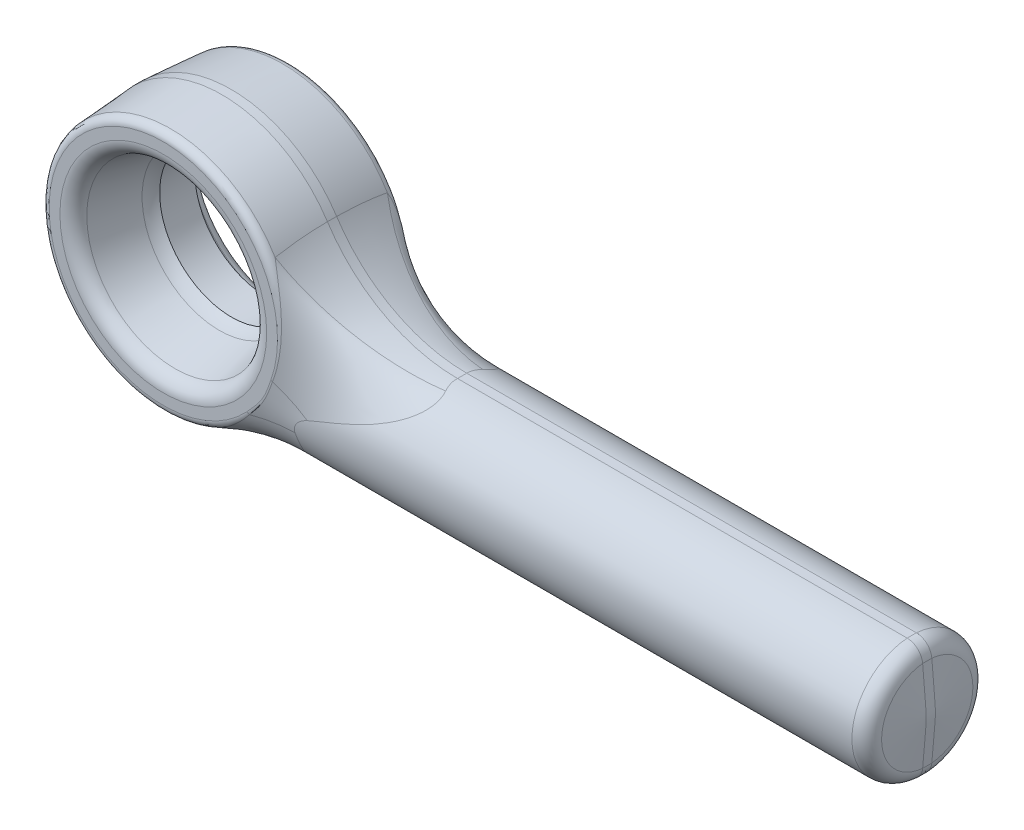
SolidWorks part; units mm, degrees
ref_plane "Plan1" through (0, 0, 0) normal (0, 0, 1) x (1, 0, 0)
ref_plane "Plan2" through (0, 0, 0) normal (0, 1, 0) x (1, 0, 0)
ref_plane "Plan3" through (0, 0, 0) normal (1, 0, 0) x (0, 0, -1)
sketch "Esquisse1" plane through (0, 0, 0) normal (0, 0, 1) x (1, 0, 0)
  circle A0 centre (0, 0) radius 16.2
  dimension "D1" = 32.4
extrude "Base-Extrusion" add sketch "Esquisse1" along normal mid plane 16.3 draft 4
sketch "Esquisse2" plane through (0, 0, 0) normal (0, 0, 1) x (1, 0, 0)
  line L0 (-20, 0) -> (20, 0) construction
  line L1 (-20, -8) -> (94.3291, -8) construction
  line L2 (0, -15.7) -> (88.1673, -15.7)
  line L3 (90.1597, -13.8743) -> (90.6737, -8)
  line L4 (0, -15.7) -> (0, -8)
  line L5 (0, -8) -> (90.6737, -8)
  circle A0 centre (0, 0) radius 15.6301 construction
  arc A1 (90.1597, -13.8743) -> (88.1673, -15.7) centre (88.1673, -13.7) cw
  point P13 (90, -15.7)
  dimension "D5" = 2
  dimension "D1" = 8
  dimension "D2" = 7.7
  dimension "D3" = 95
  dimension "D4" = 90
revolve "Boss.-Révol.1" add sketch "Esquisse2" angle 360 about L1
fillet "Congé4" radius 1
fillet "Congé5" radius 20
sketch "Esquisse3" plane through (0, 0, 0) normal (0, 1, 0) x (1, 0, 0)
  line L0 (0, 20.6238) -> (0, -15.1969) construction
  line L1 (0, 0) -> (0, -7.2198) construction
  line L2 (11.7426, -8.15) -> (0, -8.15)
  line L3 (0, 2.85) -> (0, -8.15)
  line L4 (-14.6976, -8.15) -> (14.6976, -8.15) construction
  line L5 (9, 2.85) -> (11.7426, -8.15)
  line L7 (-32.9547, 0) -> (48.0586, 0) construction
  line L8 (-20, 0) -> (94.3291, 0) construction
  line L9 (0, 2.85) -> (9, 2.85)
  dimension "D2" = 9
  dimension "D1" = 14
  dimension "D4" = 11
revolve "Enlèvement de matière-Révolution1" cut sketch "Esquisse3" angle 360 about L0
fillet "Congé13" radius 5
fillet "Congé15" radius 2
sketch "Esquisse5" plane through (0, 0, 0) normal (0, 1, 0) x (1, 0, 0)
  line L0 (0, 16.1009) -> (0, -12.7842) construction
  line L1 (0, 0) -> (0, -7.2198) construction
  line L2 (0, 5.15) -> (10.8, 5.15)
  line L4 (0, 8.15) -> (0, 5.15)
  line L5 (10.8, 5.15) -> (11.548, 8.15)
  line L6 (11.548, 8.15) -> (0, 8.15)
  line L7 (14.6976, 8.15) -> (-14.6976, 8.15) construction
  dimension "D3" = 14
  dimension "D2" = 10.8
  dimension "D1" = 3
revolve "Enlèvement de matière-Révolution2" cut sketch "Esquisse5" angle 360 about L0
fillet "Congé16" radius 2
fillet "Congé17" radius 2
scale "Echelle1"
sketch "Esquisse7" plane through (0, 0, 0) normal (0, 0, 1) x (1, 0, 0)
  line L0 (97.4644, -1.6368) -> (98.0316, -8.12)
  line L1 (97.4644, -14.6032) -> (98.0316, -8.12)
  line L24 (6.0879, -21.9105) -> (89.4898, -21.9105)
  line L25 (89.4898, 5.6705) -> (30.8393, 5.6705)
  arc A0 (3.7119, -22.1086) -> (6.0879, -21.9105) centre (6.0879, -36.2605) cw
  arc A1 (18.8032, 12.2068) -> (30.8393, 5.6705) centre (30.8393, 20.0205) ccw
  circle A2 centre (0, 0) radius 14
  arc A15 (89.4898, -21.9105) -> (97.4644, -14.6032) centre (89.4898, -13.9055) ccw
  arc A16 (18.8032, 12.2068) -> (3.7119, -22.1086) centre (0, 0) ccw
  arc A17 (97.4644, -1.6368) -> (89.4898, 5.6705) centre (89.4898, -2.3345) ccw
  dimension "D2" = 14.35
  dimension "D3" = 14.35
  dimension "D1" = 28
  dimension "D4" = 170
extrude "Boss.-Extru.1" add sketch "Esquisse7" along normal mid plane 1.2
sketch "Esquisse8" plane through (0, 0, 0) normal (0, 0, 1) x (1, 0, 0)
  line L0 (0, 0) -> (0, -82.1677) construction
  line L1 (0, -42.3205) -> (89.4898, -42.3205)
  line L16 (117.7967, -16.382) -> (118.5196, -8.12)
  line L17 (118.5196, -8.12) -> (117.7967, 0.142)
  line L18 (89.4898, 26.0805) -> (49.0921, 26.0805)
  line L20 (97.4644, -14.6032) -> (98.0316, -8.12)
  line L21 (98.0316, -8.12) -> (97.4644, -1.6368)
  line L22 (89.4898, 5.6705) -> (30.8393, 5.6705)
  line L23 (6.0879, -21.9105) -> (89.4898, -21.9105)
  line L24 (97.4644, -14.6032) -> (98.0316, -8.12)
  line L25 (98.0316, -8.12) -> (97.4644, -1.6368)
  line L26 (89.4898, 5.6705) -> (30.8393, 5.6705)
  line L27 (6.0879, -21.9105) -> (89.4898, -21.9105)
  arc A0 (25.238, 33.9716) -> (0, -42.3205) centre (0, 0) ccw
  arc A1 (49.0921, 26.0805) -> (25.238, 33.9716) centre (49.0921, 66.0805) cw
  arc A18 (89.4898, -42.3205) -> (117.7967, -16.382) centre (89.4898, -13.9055) ccw
  arc A19 (117.7967, 0.142) -> (89.4898, 26.0805) centre (89.4898, -2.3345) ccw
  arc A21 (89.4898, -21.9105) -> (97.4644, -14.6032) centre (89.4898, -13.9055) ccw
  arc A22 (97.4644, -1.6368) -> (89.4898, 5.6705) centre (89.4898, -2.3345) ccw
  arc A23 (18.8032, 12.2068) -> (30.8393, 5.6705) centre (30.8393, 20.0205) ccw
  arc A24 (18.8032, 12.2068) -> (3.7119, -22.1086) centre (0, 0) ccw
  arc A25 (6.0879, -21.9105) -> (3.7119, -22.1086) centre (6.0879, -36.2605) ccw
  arc A26 (89.4898, -21.9105) -> (97.4644, -14.6032) centre (89.4898, -13.9055) ccw
  arc A27 (97.4644, -1.6368) -> (89.4898, 5.6705) centre (89.4898, -2.3345) ccw
  arc A28 (18.8032, 12.2068) -> (30.8393, 5.6705) centre (30.8393, 20.0205) ccw
  arc A29 (18.8032, 12.2068) -> (3.7119, -22.1086) centre (0, 0) ccw
  arc A30 (6.0879, -21.9105) -> (3.7119, -22.1086) centre (6.0879, -36.2605) ccw
  dimension "D2" = 0
  dimension "D1" = 28.415
  dimension "D3" = 28.415
  dimension "D4" = 40
extrude "Boss.-Extru.2" add sketch "Esquisse8" along normal mid plane 8
fillet "Congé9" radius 4
fillet "Congé10" radius 4
draft "Dépouille1" type of draft neutral plane draft angle 60 faces to draft 9 parameters "D1"=60
draft "Dépouille3" type of draft neutral plane draft angle 60 faces to draft 9 parameters "D1"=60
fillet "Congé11" radius 2
fillet "Congé12" radius 2
sketch "Esquisse9" plane through (0, 0, 0) normal (0, 0, 1) x (1, 0, 0)
  line L2 (30.7588, -0.3276) -> (89.4898, -0.3276) construction
  line L3 (89.4898, -15.9124) -> (5.967, -15.9124) construction
  line L4 (30.7588, -0.3276) -> (89.4898, -0.3276)
  line L5 (89.4898, -15.9124) -> (5.967, -15.9124)
  circle A1 centre (0, 0) radius 9.39
  arc A2 (13.7663, 8.9153) -> (2.6687, -16.1825) centre (0, 0) ccw construction
  arc A3 (13.7663, 8.9153) -> (2.6687, -16.1825) centre (0, 0) ccw
  point P8 (91.5121, -2.1878)
  point P9 (91.5121, -14.0522)
  dimension "D1" = 18.78
extrude "Enlèv. mat.-Extru.2" cut sketch "Esquisse9" against normal mid plane 30 flip side to cut
